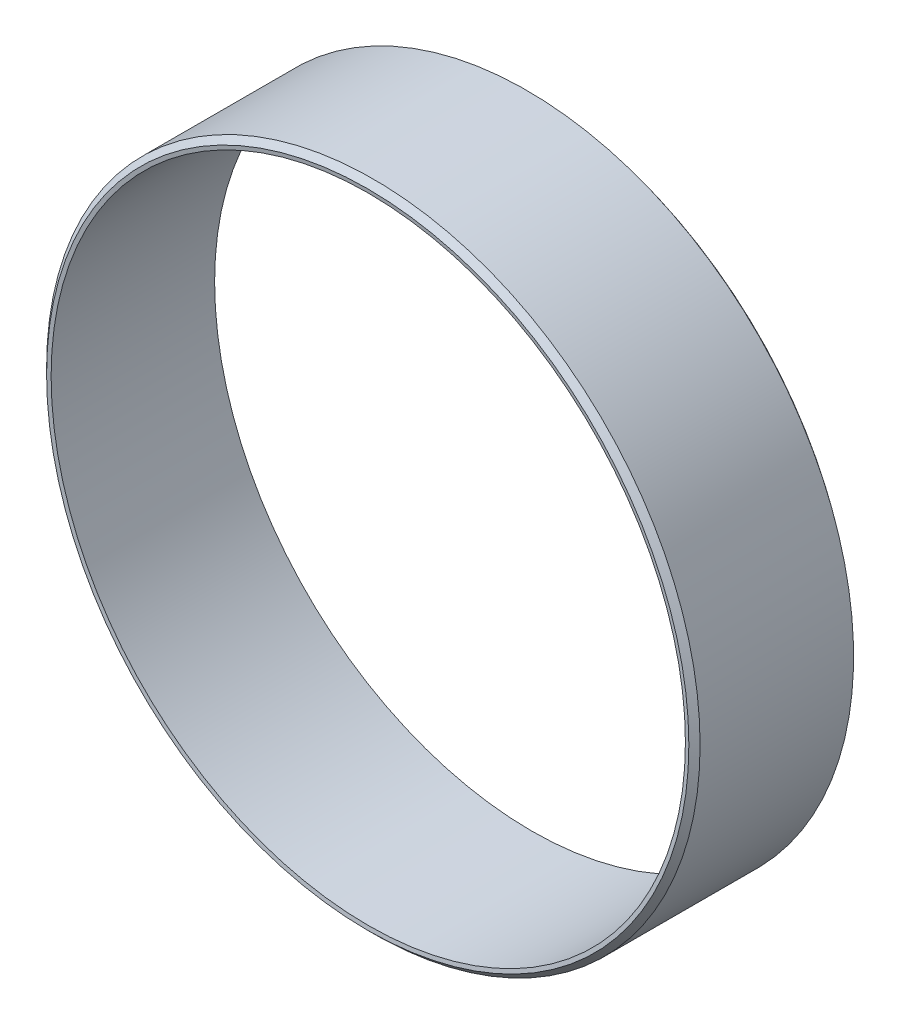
SolidWorks part; units mm, degrees
ref_plane "Front" through (0, 0, 0) normal (0, 0, 1) x (1, 0, 0)
ref_plane "Top" through (0, 0, 0) normal (0, 1, 0) x (1, 0, 0)
ref_plane "Right" through (0, 0, 0) normal (1, 0, 0) x (0, 0, -1)
sketch "Sketch1" plane through (0, 0, 0) normal (0, 0, 1) x (1, 0, 0)
  circle A0 centre (0, 0) radius 161.925
  circle A1 centre (0, 0) radius 157.1625
  dimension "D1" = 323.85
  dimension "D2" = 4.7625
extrude "Extrude1" add sketch "Sketch1" along normal blind 139.7
sketch "Sketch3" plane through (0, 0, 0) normal (0, 1, 0) x (1, 0, 0)
  line L0 (0, 155.2686) -> (0, -408.6504) construction
  line L1 (161.925, -139.7) -> (161.925, 0) construction
  line L2 (157.1625, 0) -> (-157.1625, 0) construction
  line L3 (0, -70.551) -> (0, -370.5504)
  line L4 (0, -370.5504) -> (599.9988, -370.5504)
  ellipse E0 centre (0, -370.5504) end of major axis (-599.9988, -370.5504) minor radius 299.9994 (599.9988, -370.5504) -> (0, -70.551) ccw
  point P3 (0, -370.5504)
  point P4 (0, -70.551)
  point P7 (599.9988, -370.5504)
  point P9 (161.925, -81.6825)
  dimension "D1" = 408.6504
  dimension "D2" = 299.9994
  dimension "D3" = 38.1
  dimension "D4" = 599.9988
revolve "Cut-Revolve2" cut sketch "Sketch3" angle 360 about L0
sketch "Sketch4" plane through (0, 0, 0) normal (1, 0, 0) x (0, 0, -1)
  line L0 (-2.4363, -161.925) -> (0, -158.75)
  line L1 (-81.6825, -161.925) -> (0, -161.925) construction
  line L2 (0, -161.925) -> (0, 161.925) construction
  line L3 (0, -158.75) -> (0, -161.925)
  line L4 (0, -161.925) -> (-2.4363, -161.925)
  line L5 (0, 0) -> (-62.0153, 0) construction
  dimension "D1" = 1.5875
  dimension "D2" = 37.5
revolve "Cut-Revolve3" cut sketch "Sketch4" angle 360 about L5
chamfer "Chamfer1" distance 3.175 angle 45 1 edges at (-161.925, 0, 81.6825)
ref_point "Point1"
ref_point "Point2"
